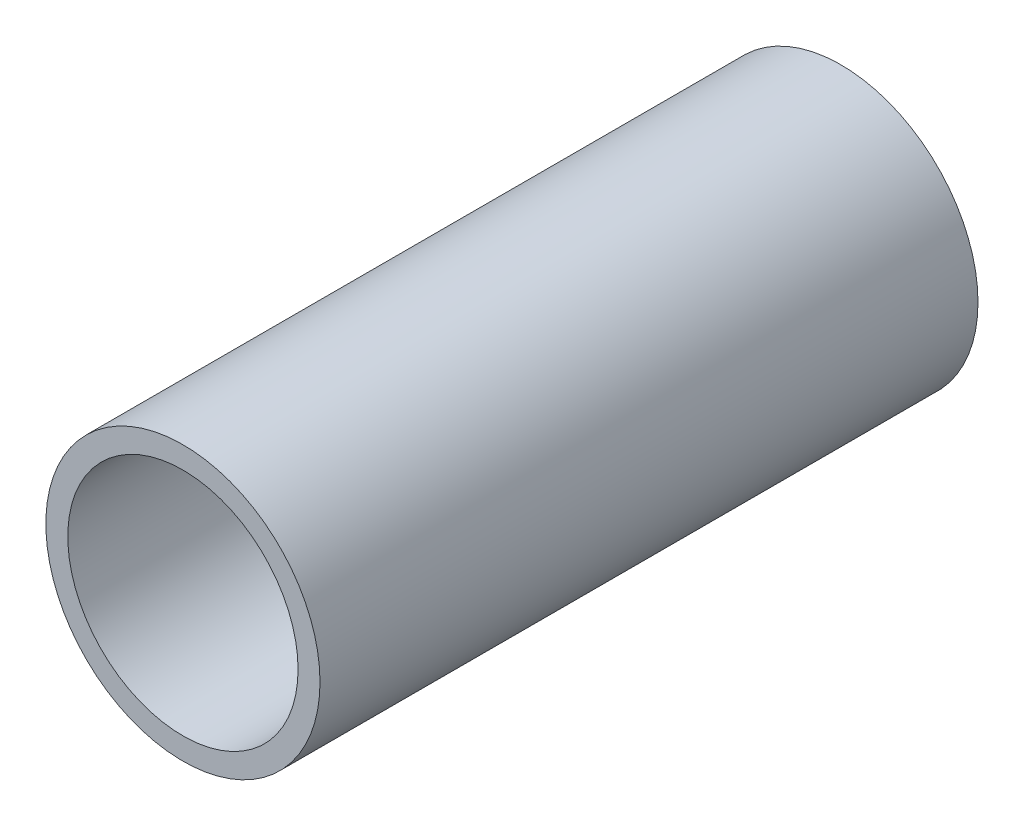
SolidWorks part; units mm, degrees
ref_plane "Plan de face" through (0, 0, 0) normal (0, 0, 1) x (1, 0, 0)
ref_plane "Plan de dessus" through (0, 0, 0) normal (0, 1, 0) x (1, 0, 0)
ref_plane "Plan de droite" through (0, 0, 0) normal (1, 0, 0) x (0, 0, -1)
sketch "Esquisse1" plane through (0, 0, 0) normal (0, 0, 1) x (-1, 0, 0)
  circle A0 centre (0, 0) radius 12.5
  circle A1 centre (0, 0) radius 10.5
  dimension "D1" = 25
  dimension "D2" = 2
extrude "Boss.-Extru.1" add sketch "Esquisse1" along normal blind 60
